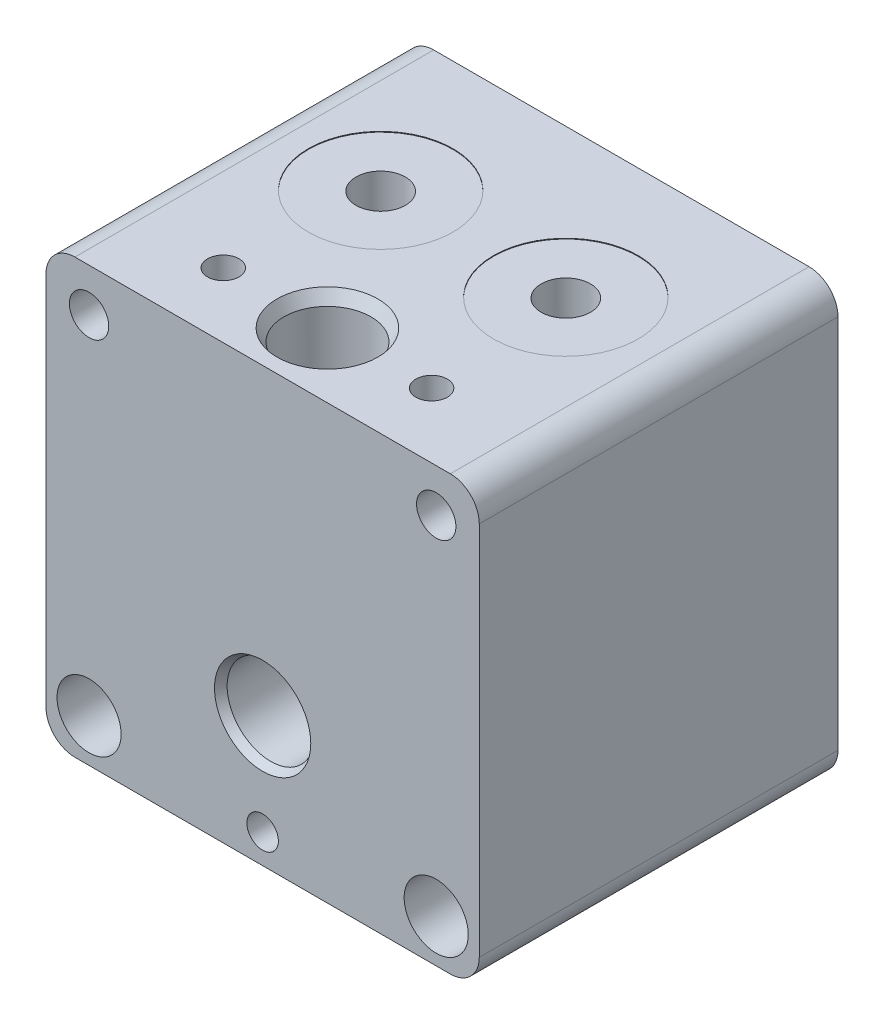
SolidWorks part; units mm, degrees
ref_plane "Plane1" through (0, 0, 0) normal (0, 0, 1) x (1, 0, 0)
ref_plane "Plane2" through (0, 0, 0) normal (0, 1, 0) x (1, 0, 0)
ref_plane "Plane3" through (0, 0, 0) normal (1, 0, 0) x (0, 0, -1)
sketch "Sketch1" plane through (0, 0, 0) normal (0, 0, 1) x (1, 0, 0)
  line L1 (23.7744, 0) -> (23.7744, 23.7744)
  line L2 (23.7744, 23.7744) -> (-23.7744, 23.7744)
  line L3 (-23.7744, 23.7744) -> (-23.7744, -23.7744)
  line L4 (-23.7744, -23.7744) -> (23.7744, -23.7744)
  line L5 (23.7744, -23.7744) -> (23.7744, 0)
  dimension "D1" = 23.7744
  dimension "D2" = 23.7744
  dimension "D3" = 23.7744
  dimension "D4" = 23.7744
extrude "Base-Extrude" add sketch "Sketch1" along normal blind 39.37
sketch "Sketch6"
  line L1 (0, 23.7744) -> (0, -22.86) construction
  line L3 (23.7744, 23.7744) -> (-23.7744, 23.7744) construction
fillet "Fillet2" radius 3.175 4 edges at (23.7744, -23.7744, 19.685) (-23.7744, -23.7744, 19.685) (-23.7744, 23.7744, 19.685) (23.7744, 23.7744, 19.685)
sketch "Sketch19" plane through (0, 0, 39.37) normal (0, 0, 1) x (1, 0, 0)
  line L0 (0, 0) -> (-7.62, 0) construction
  line L1 (0, 23.7744) -> (0, -22.86) construction
  circle A0 centre (0, -20.574) radius 1.7272
  dimension "D1" = 3.4544
  dimension "D2" = 20.574
extrude "8_32_holes" cut sketch "Sketch19" against normal blind 7.62
sketch "Sketch3" plane through (0, 0, 39.37) normal (0, 0, 1) x (1, 0, 0)
  line L0 (0, 0) -> (0, -10.16) construction
  line L1 (0, 23.7744) -> (0, -22.86) construction
  line L5 (-22.86, 0) -> (22.86, 0) construction
  circle A0 centre (-19.05, -19.05) radius 2.159
  circle A2 centre (19.05, -19.05) radius 2.159
  dimension "D1" = 19.05
  dimension "D3" = 4.318
  dimension "D2" = 19.05
extrude "corner_thru_holes" cut sketch "Sketch3" against normal through all
sketch "Sketch4" plane through (0, 0, 39.37) normal (0, 0, 1) x (1, 0, 0)
  line L0 (-20.32, 0) -> (19.05, 0) construction
  line L1 (0, 0) -> (0, -10.16) construction
  line L2 (0, 23.7744) -> (0, -22.86) construction
  circle A0 centre (-19.05, -19.05) radius 3.5179
  circle A1 centre (19.05, -19.05) radius 2.159 construction
  circle A2 centre (19.05, -19.05) radius 3.5179
  dimension "D2" = 7.0358
extrude "corner_cbore" cut sketch "Sketch4" against normal blind 7.62
sketch "Sketch10" plane through (0, 0, 39.37) normal (0, 0, 1) x (1, 0, 0)
  circle A1 centre (0, -9.525) radius 3.2385
  dimension "D1" = 9.525
  dimension "D2" = 6.477
extrude "sensors_thru_holes" cut sketch "Sketch10" against normal through all
sketch "Sketch13" plane through (0, 0, 39.37) normal (0, 0, 1) x (1, 0, 0)
  line L0 (0, 23.7744) -> (0, -22.86) construction
  circle A0 centre (0, -9.525) radius 4.7752
  circle A1 centre (0, -9.525) radius 3.2385 construction
  dimension "D1" = 9.5504
extrude "temp_cbore" cut sketch "Sketch13" against normal blind 11.684
sketch "Sketch15" plane through (0, 0, 0) normal (0, 0, -1) x (-1, 0, 0)
  circle A0 centre (0, 0) radius 17.399
  dimension "D1" = 34.798
extrude "cavity_cbore" cut sketch "Sketch15" against normal blind 22.352
sketch "Sketch16" plane through (0, 0, 0) normal (0, 0, -1) x (-1, 0, 0)
  circle A0 centre (0, 0) radius 17.4625
  dimension "D1" = 34.925
extrude "bore_oring" cut sketch "Sketch16" against normal blind 12.7
chamfer "Chamfer2" distance 0.508 angle 60 1 edges at (4.7752, -9.525, 39.37)
sketch "Sketch23" plane through (0, 23.7744, 0) normal (0, 1, 0) x (-1, 0, 0)
  circle A0 centre (10.16, 16.256) radius 2.7051
  dimension "D1" = 5.4102
  dimension "D2" = 10.16
  dimension "D3" = 16.256
extrude "uw_conn_thru" cut sketch "Sketch23" against normal blind 22.86
sketch "Sketch24" plane through (0, 23.7744, 0) normal (0, 1, 0) x (-1, 0, 0)
  circle A0 centre (10.16, 16.256) radius 7.9375
  dimension "D1" = 15.875
extrude "uw_spotface" cut sketch "Sketch24" against normal blind 0.0762
sketch "Sketch28" plane through (0, 0, 22.352) normal (0, 0, -1) x (-1, 0, 0)
  line L0 (0, 23.7744) -> (0, -22.86) construction
  circle A0 centre (0, 2.54) radius 3.175
  dimension "D1" = 6.35
  dimension "D2" = 2.54
extrude "cond_ra_drill" cut sketch "Sketch28" against normal blind 12.7
sketch "Sketch29" plane through (0, 23.7744, 0) normal (0, 1, 0) x (-1, 0, 0)
  circle A0 centre (-10.16, 16.256) radius 2.7051
  dimension "D1" = 5.4102
  dimension "D2" = 10.16
  dimension "D3" = 16.256
extrude "uw2_thru" cut sketch "Sketch29" against normal blind 22.86
sketch "Sketch30" plane through (0, 23.7744, 0) normal (0, 1, 0) x (-1, 0, 0)
  circle A0 centre (-10.16, 16.256) radius 7.9375
  dimension "D1" = 15.875
extrude "uw2_land" cut sketch "Sketch30" against normal blind 0.0762
sketch "Sketch31" plane through (0, 23.7744, 0) normal (0, 1, 0) x (-1, 0, 0)
  line L0 (0, 39.37) -> (0, 25.4) construction
  circle A1 centre (11.43, 32.258) radius 1.7272
  circle A2 centre (-11.43, 32.258) radius 1.7272
  dimension "D2" = 3.4544
  dimension "D1" = 11.43
extrude "cnd_keeper_holes" cut sketch "Sketch31" against normal blind 12.7
sketch "Sketch32" plane through (0, 23.7744, 0) normal (0, 1, 0) x (-1, 0, 0)
  line L0 (0, 0) -> (0, 39.37) construction
  line L1 (-20.5994, 39.37) -> (20.5994, 39.37) construction
  circle A0 centre (0, 32.258) radius 2.413
  dimension "D1" = 4.826
  dimension "D2" = 7.112
extrude "cnd_thru_hole" cut sketch "Sketch32" against normal blind 20.32
sketch "Sketch33" plane through (0, 23.7744, 0) normal (0, 1, 0) x (-1, 0, 0)
  circle A0 centre (0, 32.258) radius 4.7752
  circle A1 centre (0, 32.258) radius 2.413 construction
  dimension "D1" = 9.5504
extrude "cnd_cbore" cut sketch "Sketch33" against normal blind 13.716
chamfer "cnd_chamfer" distance 0.762 angle 60 1 edges at (-4.7752, 23.7744, 32.258)
sketch "Sketch34" plane through (0, 0, 0) normal (0, 0, -1) x (-1, 0, 0)
  circle A0 centre (0, 0) radius 21.336
  dimension "D1" = 42.672
extrude "endcap_land" cut sketch "Sketch34" against normal blind 3.81
chamfer "endcap_chamfer" distance 0.508 angle 60 1 edges at (-17.4625, 0, 3.81)
sketch "Sketch35" plane through (0, 0, 39.37) normal (0, 0, 1) x (1, 0, 0)
  line L0 (0, 0) -> (0, 15.24) construction
  line L1 (0, 23.7744) -> (0, -22.86) construction
  circle A0 centre (19.05, 19.05) radius 2.159
  circle A1 centre (-19.05, 19.05) radius 2.159
  dimension "D1" = 4.318
  dimension "D2" = 19.05
  dimension "D3" = 19.05
extrude "aft_guard_holes" cut sketch "Sketch35" against normal blind 31.75
sketch "Sketch36" plane through (0, 0, 0) normal (0, 0, -1) x (-1, 0, 0)
  line L0 (0, 0) -> (0, 15.24) construction
  line L1 (0, 23.7744) -> (0, -22.86) construction
  circle A0 centre (19.05, 19.05) radius 1.1303
  circle A1 centre (-19.05, 19.05) radius 1.1303
  dimension "D1" = 2.2606
extrude "plate_holes" cut sketch "Sketch36" against normal blind 30.48
